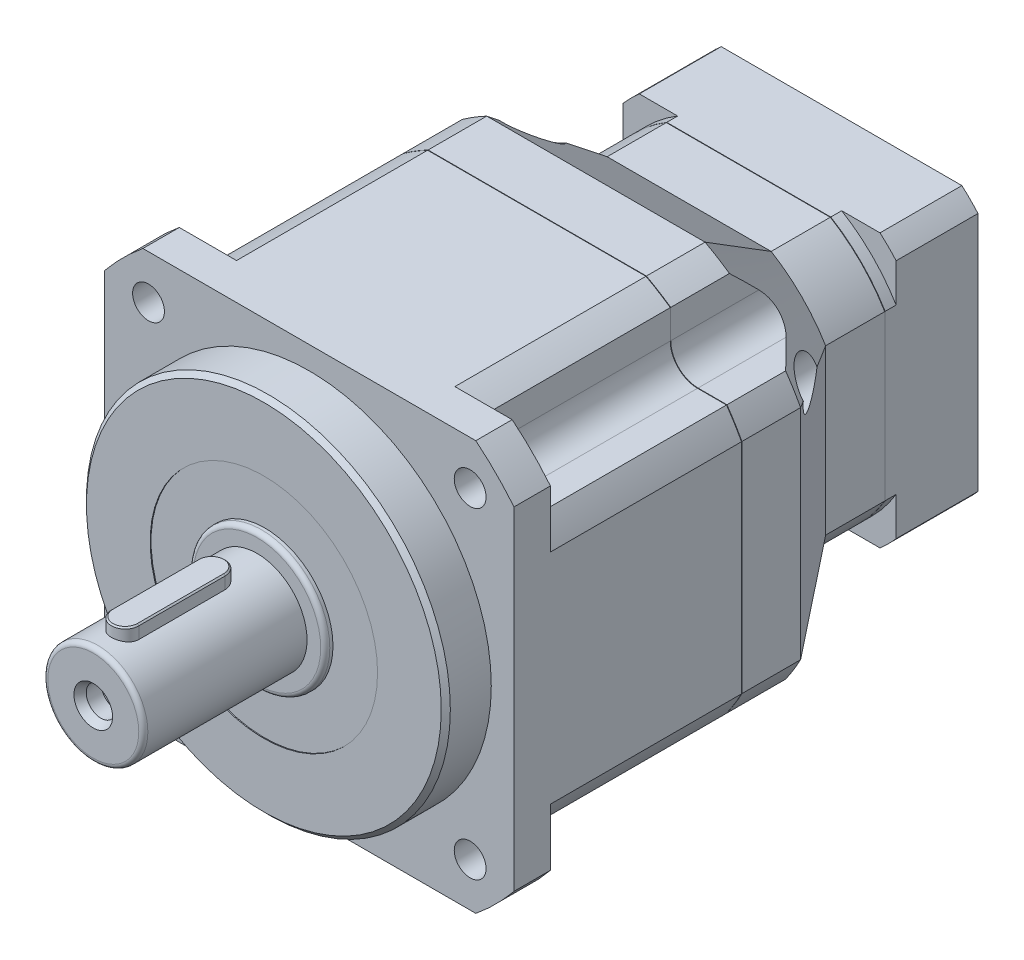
SolidWorks part; units mm, degrees
ref_plane "前视基准面" through (0, 0, 0) normal (0, 0, 1) x (1, 0, 0)
ref_plane "上视基准面" through (0, 0, 0) normal (0, 1, 0) x (1, 0, 0)
ref_plane "右视基准面" through (0, 0, 0) normal (1, 0, 0) x (0, 0, -1)
sketch "草图1" plane through (0, 0, 0) normal (0, 0, 1) x (1, 0, 0)
  line L1 (-36.5923, 45) -> (36.5923, 45)
  line L2 (-45, 36.5923) -> (-45, -36.5923)
  line L3 (-36.5923, -45) -> (36.5923, -45)
  line L4 (45, 36.5923) -> (45, -36.5923)
  arc A0 (-36.5923, 45) -> (-45, 36.5923) centre (0, 0) ccw
  arc A1 (-45, -36.5923) -> (-36.5923, -45) centre (0, 0) ccw
  arc A2 (36.5923, -45) -> (45, -36.5923) centre (0, 0) ccw
  arc A3 (45, 36.5923) -> (36.5923, 45) centre (0, 0) ccw
  dimension "D1" = 45
  dimension "D3" = 45
extrude "凸台-拉伸1" add sketch "草图1" along normal blind 8
sketch "草图2" plane through (0, 0, 8) normal (0, 0, 1) x (1, 0, 0)
  circle A0 centre (0, 0) radius 40
extrude "凸台-拉伸2" add sketch "草图2" along normal blind 10
sketch "草图3" plane through (0, 0, 0) normal (0, 0, -1) x (-1, 0, 0)
  line L1 (-24, 45) -> (24, 45)
  line L2 (-45, 24) -> (-45, -24)
  line L3 (-24, -45) -> (24, -45)
  line L4 (45, 24) -> (45, -24)
  arc A0 (-24, 45) -> (-45, 24) centre (0, 0) ccw
  arc A1 (-45, -24) -> (-24, -45) centre (0, 0) ccw
  arc A2 (24, -45) -> (45, -24) centre (0, 0) ccw
  arc A3 (45, 24) -> (24, 45) centre (0, 0) ccw
  dimension "D1" = 45
  dimension "D3" = 45
extrude "凸台-拉伸3" add sketch "草图3" along normal blind 42
sketch "草图4" plane through (0, 0, -42) normal (0, 0, -1) x (-1, 0, 0)
  line L1 (-47.4792, 48.918) -> (-29.35, 48.918)
  line L2 (-47.4792, 48.918) -> (-47.4792, 29.35)
  line L3 (-47.4792, 29.35) -> (-29.35, 29.35)
  line L4 (-29.35, 48.918) -> (-29.35, 29.35)
  dimension "D1" = 29.35
  dimension "D2" = 29.35
extrude "切除-拉伸1" cut sketch "草图4" against normal up to surface (42 mm away)
pattern_circular "阵列(圆周)1" count 4 over 360 about axis through (0, 0, 0) along (0, 0, 1) of "切除-拉伸1"
fillet "圆角1" radius 6 4 edges at (29.35, -29.35, -21) (-29.35, -29.35, -21) (-29.35, 29.35, -21) (29.35, 29.35, -21)
sketch "草图5" plane through (0, 0, 0) normal (0, 0, -1) x (-1, 0, 0)
  line L0 (0, 0) -> (-41.0122, 41.0122) construction
  circle A0 centre (0, 0) radius 50 construction
  arc A1 (-36.5923, 45) -> (-45, 36.5923) centre (0, 0) ccw construction
  circle A2 centre (-35.3553, 35.3553) radius 3.5
extrude "切除-拉伸2" cut sketch "草图5" against normal blind 42
pattern_circular "阵列(圆周)2" count 4 over 360 about axis through (0, 0, 0) along (0, 0, 1) of "切除-拉伸2"
ref_plane "基准面1" through (0, 0, -42.1) normal (0, 0, -1) x (-1, 0, 0)
sketch "草图7" plane through (0, 0, -42.1) normal (0, 0, -1) x (-1, 0, 0)
  line L1 (-24, 45) -> (24, 45)
  line L2 (-45, 24) -> (-45, -24)
  line L3 (-24, -45) -> (24, -45)
  line L4 (45, 24) -> (45, -24)
  arc A0 (-24, 45) -> (-45, 24) centre (0, 0) ccw
  arc A1 (-45, -24) -> (-24, -45) centre (0, 0) ccw
  arc A2 (24, -45) -> (45, -24) centre (0, 0) ccw
  arc A3 (45, 24) -> (24, 45) centre (0, 0) ccw
  dimension "D1" = 45
  dimension "D3" = 45
extrude "凸台-拉伸4" add sketch "草图7" along normal blind 12.9 separate body
ref_plane "基准面2" through (0, 0, -75.5) normal (0, 0, -1) x (-1, 0, 0)
sketch "草图10" plane through (0, 0, -75.5) normal (0, 0, -1) x (-1, 0, 0)
  line L1 (-18.0278, 30) -> (18.0278, 30)
  line L2 (-30, 18.0278) -> (-30, -18.0278)
  line L3 (-18.0278, -30) -> (18.0278, -30)
  line L4 (30, 18.0278) -> (30, -18.0278)
  arc A0 (18.0278, -30) -> (30, -18.0278) centre (0, 0) ccw
  arc A1 (-30, -18.0278) -> (-18.0278, -30) centre (0, 0) ccw
  arc A2 (-18.0278, 30) -> (-30, 18.0278) centre (0, 0) ccw
  arc A3 (30, 18.0278) -> (18.0278, 30) centre (0, 0) ccw
  dimension "D1" = 30
  dimension "D3" = 30
extrude "凸台-拉伸5" add sketch "草图10" along normal blind 13 separate body
loft "放样1" add
sketch "草图9" plane through (0, 0, -42.1) normal (0, 0, 1) x (1, 0, 0)
  line L0 (29.35, 35.35) -> (29.35, 41.7082) construction
  line L1 (41.7082, 29.35) -> (35.35, 29.35) construction
  line L2 (29.35, 35.35) -> (29.35, 41.7082)
  line L3 (41.7082, 29.35) -> (35.35, 29.35)
  arc A0 (29.35, 35.35) -> (35.35, 29.35) centre (35.35, 35.35) ccw construction
  arc A1 (29.35, 35.35) -> (35.35, 29.35) centre (35.35, 35.35) ccw
  arc A2 (41.7082, 29.35) -> (29.35, 41.7082) centre (0, 0) ccw
extrude "切除-拉伸3" cut sketch "草图9" against normal blind 30
pattern_circular "阵列(圆周)3" count 4 over 360 about axis through (0, 0, 0) along (0, 0, 1) of "切除-拉伸3"
ref_plane "基准面3" through (0, 0, -88.6) normal (0, 0, -1) x (-1, 0, 0)
sketch "草图11" plane through (0, 0, -88.6) normal (0, 0, -1) x (-1, 0, 0)
  line L1 (-18.0278, 30) -> (18.0278, 30)
  line L2 (-30, 18.0278) -> (-30, -18.0278)
  line L3 (-18.0278, -30) -> (18.0278, -30)
  line L4 (30, 18.0278) -> (30, -18.0278)
  arc A0 (-18.0278, 30) -> (-30, 18.0278) centre (0, 0) ccw
  arc A1 (-30, -18.0278) -> (-18.0278, -30) centre (0, 0) ccw
  arc A2 (18.0278, -30) -> (30, -18.0278) centre (0, 0) ccw
  arc A3 (30, 18.0278) -> (18.0278, 30) centre (0, 0) ccw
  dimension "D1" = 30
  dimension "D3" = 30
extrude "凸台-拉伸6" add sketch "草图11" along normal blind 2.4 separate body
sketch "草图12" plane through (0, 0, -91) normal (0, 0, -1) x (-1, 0, 0)
  line L1 (-26.4575, 30) -> (26.4575, 30)
  line L2 (-30, 26.4575) -> (-30, -26.4575)
  line L3 (-26.4575, -30) -> (26.4575, -30)
  line L4 (30, 26.4575) -> (30, -26.4575)
  arc A0 (-26.4575, 30) -> (-30, 26.4575) centre (0, 0) ccw
  arc A1 (-30, -26.4575) -> (-26.4575, -30) centre (0, 0) ccw
  arc A2 (26.4575, -30) -> (30, -26.4575) centre (0, 0) ccw
  arc A3 (30, 26.4575) -> (26.4575, 30) centre (0, 0) ccw
  dimension "D1" = 30
  dimension "D3" = 30
extrude "凸台-拉伸7" add sketch "草图12" along normal blind 18
sketch "草图13" plane through (0, 0, -109) normal (0, 0, -1) x (-1, 0, 0)
  circle A0 centre (0, 0) radius 25
extrude "切除-拉伸4" cut sketch "草图13" against normal blind 5
sketch "草图14" plane through (0, 0, -109) normal (0, 0, -1) x (-1, 0, 0)
  line L0 (0, 0) -> (0, -25) construction
  line L1 (0, 0) -> (6.4705, -24.1481) construction
  circle A0 centre (0, 0) radius 25 construction
  circle A1 centre (6.4705, -24.1481) radius 4
  dimension "D1" = 15
extrude "切除-拉伸5" cut sketch "草图14" against normal blind 12
pattern_circular "阵列(圆周)4" count 4 over 360 about axis through (0, 0, 0) along (0, 0, 1) of "切除-拉伸5"
sketch "草图15" plane through (0, 0, -109) normal (0, 0, -1) x (-1, 0, 0)
  line L0 (0, 0) -> (-24.1481, -6.4705) construction
  line L1 (0, 0) -> (-16.6272, -18.6691) construction
  arc A0 (-22.8071, -10.239) -> (2.5363, -24.871) centre (0, 0) ccw construction
  circle A1 centre (-16.6272, -18.6691) radius 4
extrude "切除-拉伸6" cut sketch "草图15" against normal blind 12
pattern_circular "阵列(圆周)5" count 2 over 360 about axis through (0, 0, 0) along (0, 0, 1) of "切除-拉伸6"
sketch "草图16" plane through (0, 0, -104) normal (0, 0, -1) x (-1, 0, 0)
  circle A0 centre (0, 0) radius 19
extrude "切除-拉伸7" cut sketch "草图16" against normal blind 13
ref_plane "基准面4" through (0, 0, -102.5) normal (0, 0, -1) x (-1, 0, 0)
sketch "草图17" plane through (0, 0, -102.5) normal (0, 0, -1) x (-1, 0, 0)
  circle A0 centre (0, 0) radius 16.5
extrude "凸台-拉伸8" add sketch "草图17" against normal up to surface (11.5 mm away)
chamfer "倒角1" distance 1 angle 45 1 edges at (-16.5, 0, -102.5)
sketch "草图18" plane through (0, 0, -102.5) normal (0, 0, -1) x (-1, 0, 0)
  line L1 (-17.8222, 0.5) -> (17.9653, 0.5)
  line L2 (-17.8222, 0.5) -> (-17.8222, -0.5)
  line L3 (-17.8222, -0.5) -> (17.9653, -0.5)
  line L4 (17.9653, 0.5) -> (17.9653, -0.5)
  dimension "D1" = 0.5
  dimension "D2" = 1
extrude "切除-拉伸8" cut sketch "草图18" against normal up to surface (11.5 mm away)
sketch "草图19" plane through (0, 0, -109) normal (0, 0, -1) x (-1, 0, 0)
  circle A0 centre (0, 0) radius 7
extrude "切除-拉伸9" cut sketch "草图19" against normal blind 34
sketch "草图20" plane through (0, 0, -109) normal (0, 0, -1) x (-1, 0, 0)
  line L0 (0, 0) -> (-24.7487, 24.7487) construction
  circle A0 centre (0, 0) radius 35 construction
hole_wizard "M4 螺纹孔1" positions "3D草图1" profile "草图21" tap size "M4" standard "GB"
sketch3d "3D草图1"
  point P0 (24.7487, 24.7487, -109)
sketch "草图21" plane through (24.7487, 24.7487, -109) normal (1, 0, 0) x (0, 1, 0)
  line L0 (0, 0) -> (0, 16.4914)
  line L1 (0, 16.4914) -> (1.65, 15.5)
  line L2 (1.65, 15.5) -> (1.65, 0)
  line L5 (1.65, 0) -> (0, 0)
  line L10 (0, 16.4914) -> (-1.65, 15.5) construction
  line L11 (0, -6.35) -> (0, 107.95) construction
  dimension "螺纹孔钻头直径" = 3.3
  dimension "螺纹孔钻头深度" = 15.5
  dimension "导头角度" = 118
pattern_circular "阵列(圆周)6" count 4 over 360 about axis through (0, 0, 0) along (0, 0, 1) of "M4 螺纹孔1"
sketch "草图22" plane through (0, 0, -97) normal (0, 0, -1) x (-1, 0, 0)
  line L1 (-5.8017, 25.4273) -> (-7.2438, 25.3668)
  line L2 (-7.2438, 25.3668) -> (-7.9126, 24.0877)
  line L3 (-7.9126, 24.0877) -> (-7.1392, 22.869)
  line L4 (-7.1392, 22.869) -> (-5.6971, 22.9294)
  line L5 (-5.6971, 22.9294) -> (-5.0284, 24.2086)
  line L6 (-5.0284, 24.2086) -> (-5.8017, 25.4273)
  circle A0 centre (-6.4705, 24.1481) radius 3
  circle A1 centre (-6.4705, 24.1481) radius 1.25 construction
  dimension "D1" = 2.5
extrude "凸台-拉伸9" add sketch "草图22" along normal blind 6
pattern_circular "阵列(圆周)7" count 4 over 360 about axis through (0, 0, 0) along (0, 0, 1) of "凸台-拉伸9"
sketch "草图23" plane through (0, 0, -97) normal (0, 0, -1) x (-1, 0, 0)
  line L1 (-15.965, -17.3866) -> (-17.4068, -17.4544)
  line L2 (-17.4068, -17.4544) -> (-18.069, -18.7369)
  line L3 (-18.069, -18.7369) -> (-17.2894, -19.9516)
  line L4 (-17.2894, -19.9516) -> (-15.8476, -19.8839)
  line L5 (-15.8476, -19.8839) -> (-15.1854, -18.6013)
  line L6 (-15.1854, -18.6013) -> (-15.965, -17.3866)
  circle A0 centre (-16.6272, -18.6691) radius 3
  circle A1 centre (-16.6272, -18.6691) radius 1.25 construction
  dimension "D1" = 2.5
extrude "凸台-拉伸10" add sketch "草图23" along normal blind 6
pattern_circular "阵列(圆周)8" count 2 over 360 about axis through (0, 0, 0) along (0, 0, 1) of "凸台-拉伸10"
sketch "草图24" plane through (0, 0, 18) normal (0, 0, 1) x (1, 0, 0)
  circle A0 centre (0, 0) radius 15
extrude "凸台-拉伸11" add sketch "草图24" along normal blind 1.5
sketch "草图25" plane through (0, 0, 19.5) normal (0, 0, 1) x (1, 0, 0)
  circle A0 centre (0, 0) radius 11
extrude "凸台-拉伸12" add sketch "草图25" along normal blind 36
fillet "圆角3" radius 1 1 edges at (11, 0, 55.5)
fillet "圆角4" radius 1 1 edges at (15, 0, 19.5)
sketch "草图26" plane through (0, 0, 18) normal (0, 0, 1) x (1, 0, 0)
  circle A0 centre (0, 0) radius 25
  circle A1 centre (0, 0) radius 15
extrude "切除-拉伸10" cut sketch "草图26" against normal blind 0.2
chamfer "倒角2" distance 1 angle 45 1 edges at (40, 0, 18)
sketch "草图27" plane through (0, 0, 0) normal (0, 1, 0) x (1, 0, 0)
  line L0 (-10, -55.5) -> (10, -55.5) construction
  line L1 (-3, -29.5) -> (-3, -48.5)
  line L2 (3, -29.5) -> (3, -48.5)
  arc A0 (-3, -48.5) -> (3, -48.5) centre (0, -48.5) ccw
  arc A1 (3, -29.5) -> (-3, -29.5) centre (0, -29.5) ccw
  dimension "D1" = 7
  dimension "D2" = 19
extrude "凸台-拉伸13" add sketch "草图27" along normal blind 13.5
chamfer "倒角3" distance 0.3 angle 45 4 edges at (-3, 13.5, 39) (0, 13.5, 51.5) (0, 13.5, 26.5) (3, 13.5, 39)
ref_plane "基准面5" through (0, 0, -49) normal (0, 0, 1) x (1, 0, 0)
sketch "草图28" plane through (0, 0, -49) normal (0, 0, 1) x (1, 0, 0)
  line L0 (0, 0) -> (0, 45) construction
  line L1 (0, 0) -> (38.9711, 22.5) construction
  circle A0 centre (0, 0) radius 45 construction
  circle A1 centre (38.9711, 22.5) radius 4.5
  dimension "D1" = 90
  dimension "D2" = 60
extrude "切除-拉伸11" cut sketch "草图28" against normal blind 20
pattern_circular "阵列(圆周)9" count 4 over 360 about axis through (0, 0, 0) along (0, 0, 1) of "切除-拉伸11"
sketch "草图29" plane through (0, 0, -49) normal (0, 0, -1) x (-1, 0, 0)
  line L1 (-38.0904, 23.9914) -> (-39.8224, 24.0084)
  line L2 (-39.8224, 24.0084) -> (-40.7031, 22.517)
  line L3 (-40.7031, 22.517) -> (-39.8518, 21.0086)
  line L4 (-39.8518, 21.0086) -> (-38.1199, 20.9916)
  line L5 (-38.1199, 20.9916) -> (-37.2392, 22.483)
  line L6 (-37.2392, 22.483) -> (-38.0904, 23.9914)
  circle A0 centre (-38.9711, 22.5) radius 3.5
  circle A1 centre (-38.9711, 22.5) radius 1.5 construction
  dimension "D1" = 3
extrude "凸台-拉伸14" add sketch "草图29" along normal blind 7
pattern_circular "阵列(圆周)10" count 4 over 360 about axis through (0, 0, 0) along (0, 0, 1) of "凸台-拉伸14"
sketch "草图30" plane through (0, 0, 55.5) normal (0, 0, 1) x (1, 0, 0)
  circle A0 centre (0, 0) radius 3.25
extrude "切除-拉伸12" cut sketch "草图30" against normal blind 5
ref_plane "基准面6" through (0, 0, 53.8) normal (0, 0, 1) x (1, 0, 0)
sketch "草图31" plane through (0, 0, 53.8) normal (0, 0, 1) x (1, 0, 0)
  circle A0 centre (0, 0) radius 3.25 construction
  circle A1 centre (0, 0) radius 3.25
sketch "草图32" plane through (0, 0, 55.5) normal (0, 0, 1) x (1, 0, 0)
  circle A0 centre (0, 0) radius 4.25
loft "切除-放样1" cut profiles "草图31", "草图32"
hole_wizard "M5 螺纹孔1" positions "3D草图2" profile "草图33" tap size "M5" standard "GB"
sketch3d "3D草图2"
  line L0 (0, 0, 50.5) -> (0, 0, 53.8) construction
  point P0 (0, 0, 50.5)
sketch "草图33" plane through (0, 0, 50.5) normal (1, 0, 0) x (0, -1, 0)
  line L0 (0, 0) -> (0, 18.2618)
  line L1 (0, 18.2618) -> (2.1, 17)
  line L2 (2.1, 17) -> (2.1, 0)
  line L5 (2.1, 0) -> (0, 0)
  line L10 (0, 18.2618) -> (-2.1, 17) construction
  line L11 (0, -6.35) -> (0, 107.95) construction
  dimension "螺纹孔钻头直径" = 4.2
  dimension "螺纹孔钻头深度" = 17
  dimension "导头角度" = 118
